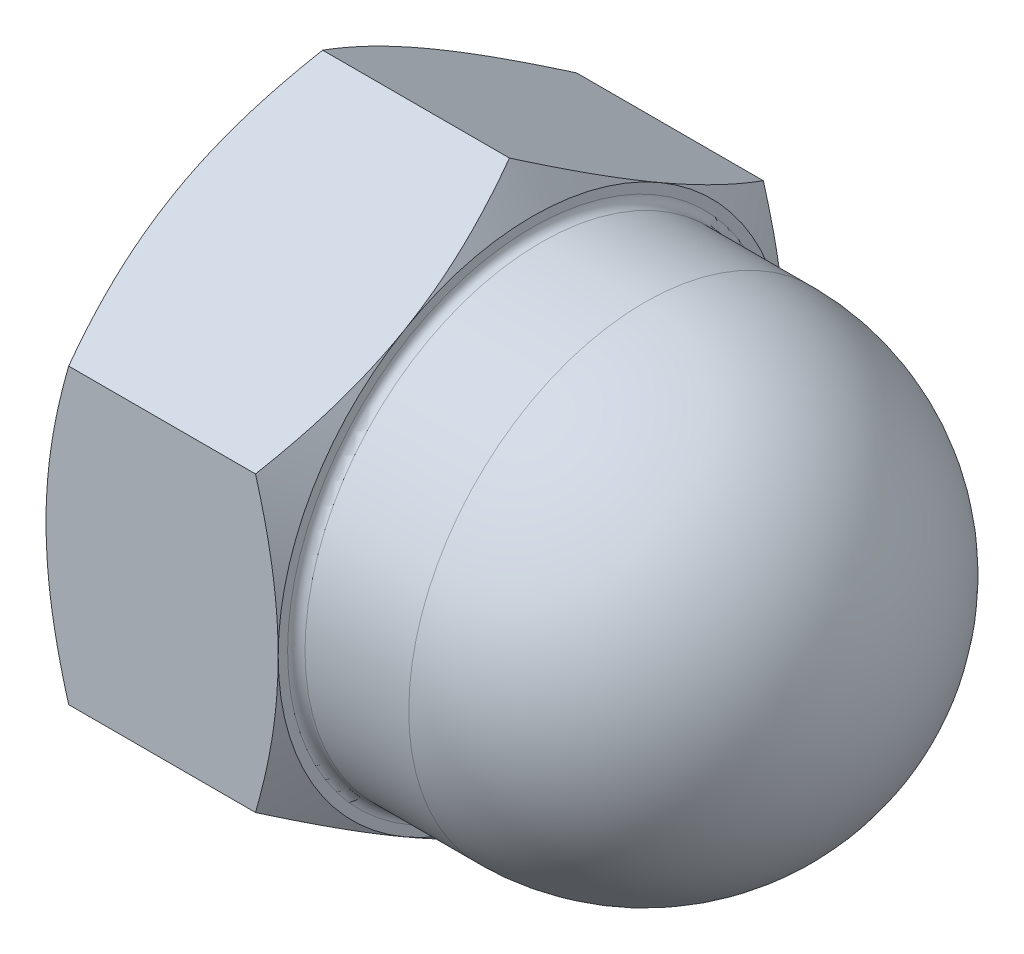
SolidWorks part; units mm, degrees
ref_plane "Plane1" through (0, 0, 0) normal (0, 0, 1) x (1, 0, 0)
ref_plane "Plane2" through (0, 0, 0) normal (0, 1, 0) x (1, 0, 0)
ref_plane "Plane3" through (0, 0, 0) normal (1, 0, 0) x (0, 0, -1)
sketch "BaseNutSke" plane through (0, 0, 0) normal (1, 0, 0) x (0, 0, -1)
  line L6 (3.5, 2.0207) -> (3.5, -2.0207)
  line L7 (-3.5, 2.0207) -> (-3.5, -2.0207)
  line L8 (3.5, 2.0207) -> (0, 4.0415)
  line L9 (0, 4.0415) -> (-3.5, 2.0207)
  line L10 (-3.5, -2.0207) -> (0, -4.0415)
  line L11 (0, -4.0415) -> (3.5, -2.0207)
  dimension "D4" = 60
  dimension "D1" = 120
  dimension "D2" = 3.5
  dimension "D3" = 3.5
  dimension "Width_flats" = 7
extrude "BaseNut" add sketch "BaseNutSke" along normal blind 3.2
sketch "DomeSke" plane through (0, 0, 0) normal (0, 0, 1) x (1, 0, 0)
  line L0 (0, 0) -> (63.5, 0) construction
  line L1 (0, 2.0207) -> (0, -2.0207) construction
  line L2 (8, 0) -> (0, 0)
  line L3 (0, 3.25) -> (4.75, 3.25)
  line L4 (0, -3.25) -> (22.225, -14) construction
  line L5 (0, 3.25) -> (0, 0)
  arc A0 (4.75, 3.25) -> (8, 0) centre (4.75, 0) cw
  dimension "Dome_rad" = 3.25
  dimension "Overall_ht" = 8
revolve "Dome" add sketch "DomeSke" angle 360 about L0
sketch "Sketch4" plane through (0, 0, 0) normal (0, 0, 1) x (1, 0, 0)
  line L0 (0, 3.5) -> (0.6494, 4.6248)
  line L1 (3.2, 3.5) -> (2.5506, 4.6248)
  line L2 (0.6494, 4.6248) -> (2.5506, 4.6248)
  line L3 (3.2, 3.5) -> (5.2, 3.5)
  line L4 (5.2, 3.5) -> (5.2, 18.5)
  line L5 (5.2, 18.5) -> (-2, 18.5)
  line L6 (0, 3.5) -> (-2, 3.5)
  line L7 (-2, 3.5) -> (-2, 18.5)
  line L8 (3.2, 4.0415) -> (3.2, 2.0207) construction
  line L9 (0, 4.0415) -> (0, 2.0207) construction
  line L10 (0, 0) -> (57.15, 0) construction
  line L11 (3.2, 4.0415) -> (0, 4.0415) construction
  point P17 (3.2, 3.5)
  dimension "D1" = 30
  dimension "D2" = 30
  dimension "D3" = 2
  dimension "D4" = 2
  dimension "D5" = 0.5833
  dimension "D6" = 15
  dimension "D7" = 3.5
revolve "DoubleChamfer" cut sketch "Sketch4" angle 360 about L10
sketch "TapDriSke" plane through (0, 0, 0) normal (0, 0, 1) x (1, 0, 0)
  line L0 (0, 0) -> (44.45, 0) construction
  line L1 (0, 1.65) -> (4.8, 1.65)
  line L2 (0, 3.0311) -> (0, 0) construction
  line L3 (4.8, 1.65) -> (5.7914, 0)
  line L4 (0, 0) -> (63.5, 0) construction
  line L5 (5.7914, 0) -> (0, 0)
  line L6 (0, 0) -> (0, 1.65)
  line L7 (4.8, -1.65) -> (5.7914, 0) construction
  line L8 (0, -1.65) -> (4.8, -1.65) construction
  line L9 (1, 6.35) -> (1, 3.175) construction
  dimension "TPA" = 118
  dimension "Thread_min" = 3.3
  dimension "Drill_depth" = 4.8
  dimension "Drill_clr" = 2
revolve "TapDrill" cut sketch "TapDriSke"
revolve "EndChamfer" cut sketch "EndChamferSketch" angle 360 about L4
sketch "EndChamferSketch" plane through (0, 0, 0) normal (0, 0, 1) x (1, 0, 0)
  line L0 (-0.0254, 2) -> (0.0254, 2)
  line L1 (0.0254, 2) -> (0.295, 1.615)
  line L2 (0.295, 1.615) -> (-0.0254, 1.615)
  line L3 (-0.0254, 1.615) -> (-0.0254, 2)
  line L4 (0, 0) -> (-15.875, 0) construction
  dimension "D1" = 0.0508
  dimension "D2" = 35
  dimension "D3" = 0.0254
  dimension "ChamferDepth" = 0.385
  dimension "ThreadMajor" = 2
revolve "Undercut" cut sketch "UcutSke" angle 360 about L0
sketch "UcutSke" plane through (0, 0, 0) normal (0, 0, 1) x (1, 0, 0)
  line L0 (0, 0) -> (38.1, 0) construction
  line L1 (4.0736, 2.02) -> (3.86, 1.65)
  line L2 (3.86, 0.25) -> (5.26, 0.25)
  line L3 (5.26, 0.25) -> (5.26, 2.02)
  line L4 (5.26, 2.02) -> (4.0736, 2.02)
  line L5 (3.86, 0.25) -> (3.86, 1.65)
  line L6 (4.8, 1.65) -> (0, 1.65) construction
  line L7 (0, 3.0311) -> (0, 0) construction
  dimension "D1" = 0.5
  dimension "D2" = 240
  dimension "Ucut_dia" = 4.04
  dimension "Ucut_dep" = 5.26
  dimension "Ucut_wid" = 1.4
sketch "ThdSchSke" plane through (0, 0, 0) normal (0, 1, 0) x (1, 0, 0)
  line L0 (0.0381, 2) -> (-0.207, 1.65)
  line L1 (-0.207, 1.65) -> (-0.207, 0.825)
  line L2 (-0.207, 0.825) -> (0.2832, 0.825)
  line L3 (0.2832, 0.825) -> (0.2832, 1.65)
  line L4 (0.2832, 1.65) -> (0.0381, 2)
  line L5 (-38.1, 0) -> (3.175, 0) construction
  line L6 (0, 0) -> (-15.875, 0) construction
  line L7 (0, 0) -> (63.5, 0) construction
  line L9 (0.7381, -7.525) -> (0.7381, -13.875) construction
  dimension "D1" = 0.0381
  dimension "VeeAngle" = 70
  dimension "SideAngle" = 55
  dimension "Thread_major" = 4
  dimension "Tap_drill" = 3.3
  dimension "OverCut" = 1.65
  dimension "Advance" = 0.7
revolve "ThreadSchematic" [suppressed] cut sketch "ThdSchSke" angle 360 about L5
pattern_linear "ThdSchPat" [suppressed]
fillet "DomeFillet" radius 0.12 1 edges at (3.2, 0, 3.25)
equation "' \"Width_flats@BaseNutSke\" = 30"
equation "' \"Hex_ht@BaseNut\" = 16"
equation "' \"Overall_ht@DomeSke\" = 34"
equation "' \"Dome_rad@DomeSke\" = 14"
equation "' \"Thread_min@TapDriSke\" = 17.5"
equation "' \"Drill_clr@TapDriSke\" = 5.0"
equation "' \"Advance@ThdSchSke\" = 2.5"
equation "' \"Thread_nominal@ThreadCosmetic\" = 20"
equation "' \"Radius@DomeFillet\" = 0.5"
equation "' \"Ucut_wid@UcutSke\" = 9.3"
equation "' \"Ucut_dep@UcutSke\" = 26.42"
equation "\"Drill_depth@TapDriSke\" = \"Overall_ht@DomeSke\"  - \"Drill_clr@TapDriSke\" - 0.3 * \"Thread_nominal@ThreadCosmetic\""
equation "\"Ucut_dia@UcutSke\" = \"Thread_nominal@ThreadCosmetic\" * 1.01"
equation "\"Thread_depth@ThreadCosmetic\" = \"Ucut_dep@UcutSke\" - \"Ucut_wid@UcutSke\" + ( \"Thread_nominal@ThreadCosmetic\" - \"Thread_min@TapDriSke\" ) / 2 * 0.57735"
equation "\"D2@BaseNutSke\" = \"Width_flats@BaseNutSke\" / 2"
equation "\"D3@BaseNutSke\" = \"Width_flats@BaseNutSke\" / 2"
equation "\"D7@Sketch4\" = \"Width_flats@BaseNutSke\" / 2"
equation "\"D5@Sketch4\" = \"Width_flats@BaseNutSke\" / 12"
equation "\"Thread_major@ThdSchSke\" = \"Thread_nominal@ThreadCosmetic\""
equation "\"Tap_drill@ThdSchSke\" = \"Thread_min@TapDriSke\""
equation "\"Overcut@ThdSchSke\" = \"Tap_drill@ThdSchSke\" * 0.5"
equation "\"Num_threads@ThdSchPat\" = int(  ( \"Thread_depth@ThreadCosmetic\" - 0.002 ) / \"Advance@ThdSchSke\" + 0.999 )  + 1"
equation "\"Advance@ThdSchPat\" = ( \"Thread_depth@ThreadCosmetic\" - 0.002 ) /  (\"Num_threads@ThdSchPat\" - 1) 'relax it"
equation "\"ThreadMajor@EndChamferSketch\" = \"Thread_nominal@ThreadCosmetic\" * 0.5"
equation "\"ChamferDepth@EndChamferSketch\" = (\"Thread_nominal@ThreadCosmetic\" - \"Thread_min@TapDriSke\") * 0.55"
